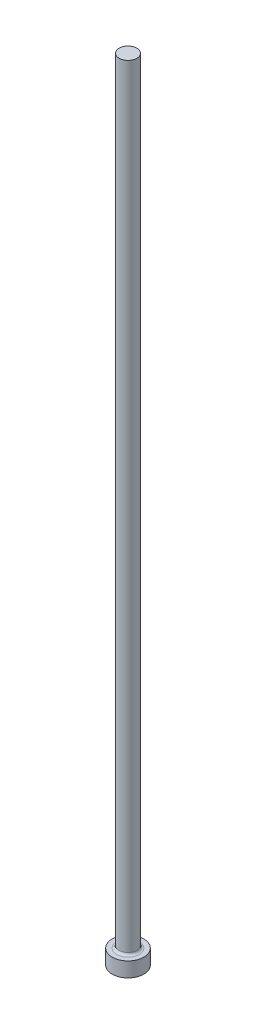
SolidWorks part; units mm, degrees
ref_plane "Front Plane" through (0, 0, 0) normal (0, 0, 1) x (1, 0, 0)
ref_plane "Top Plane" through (0, 0, 0) normal (0, 1, 0) x (1, 0, 0)
ref_plane "Right Plane" through (0, 0, 0) normal (1, 0, 0) x (0, 0, -1)
sketch "Sketch1" plane through (0, 0, 0) normal (0, 0, 1) x (1, 0, 0)
  line L0 (0, 0) -> (5.08, 0)
  line L1 (55, 0) -> (-55, 0) construction
  line L2 (5.08, 0) -> (5.08, 4.7498)
  line L3 (5.08, 4.7498) -> (3.603, 4.7498)
  line L4 (2.841, 5.5118) -> (2.841, 254)
  line L5 (2.841, 254) -> (0, 254)
  line L6 (0, 254) -> (0, 0)
  arc A0 (3.603, 4.7498) -> (2.841, 5.5118) centre (3.603, 5.5118) cw
  dimension "D5" = 0.762
  dimension "D1" = 2.841
  dimension "D2" = 5.08
  dimension "D3" = 4.7498
  dimension "D4" = 254
revolve "Revolve1" add sketch "Sketch1" angle 360 about L6
